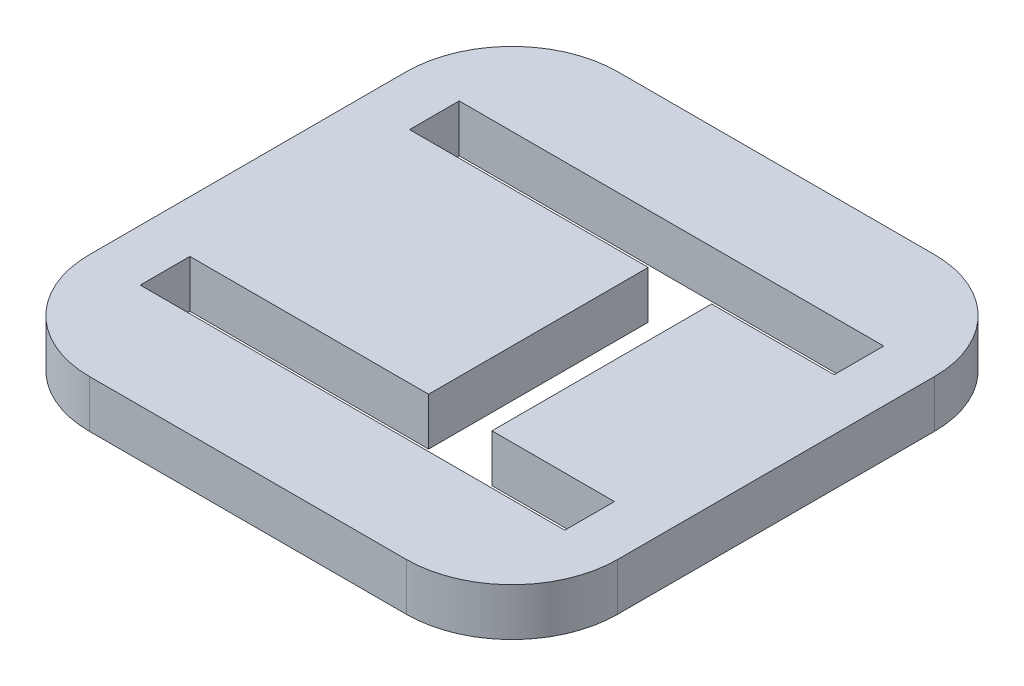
SolidWorks part; units mm, degrees
ref_plane "Plan de face" through (0, 0, 0) normal (0, 0, 1) x (1, 0, 0)
ref_plane "Plan de dessus" through (0, 0, 0) normal (0, 1, 0) x (1, 0, 0)
ref_plane "Plan de droite" through (0, 0, 0) normal (1, 0, 0) x (0, 0, -1)
sketch "Esquisse1" plane through (0, 0, 0) normal (0, 1, 0) x (1, 0, 0)
  line L0 (-85, 0) -> (15, 0) construction
  line L1 (-65, -50) -> (-5, -50)
  line L2 (-85, -30) -> (-85, 30)
  line L3 (-65, 50) -> (-5, 50)
  line L4 (15, -30) -> (15, 30)
  line L5 (5, 30) -> (5, 21) construction
  line L6 (-75, -21) -> (-75, -30) construction
  line L7 (-75.2, -30.2) -> (5.2, -30.2)
  line L8 (-75.2, -30.2) -> (-75.2, -20.8)
  line L9 (-75.2, -20.8) -> (-30, -20.8)
  line L10 (5.2, -30.2) -> (5.2, -20.8)
  line L11 (5.2, 20.8) -> (-18, 20.8)
  line L12 (5.2, 20.8) -> (5.2, 30.2)
  line L13 (5.2, 30.2) -> (-75.2, 30.2)
  line L14 (-75.2, 20.8) -> (-75.2, 30.2)
  line L15 (-75, -30) -> (5, -30) construction
  line L16 (5, -21) -> (5, -30) construction
  line L17 (5, 30) -> (5, 21) construction
  line L18 (-75, 30) -> (5, 30) construction
  line L19 (-75, 21) -> (5, 21) construction
  line L20 (-75, 30) -> (-75, 21) construction
  line L21 (-18, -20.8) -> (5.2, -20.8)
  line L22 (-30, 20.8) -> (-75.2, 20.8)
  line L23 (-30, -20.8) -> (-30, 20.8)
  line L24 (-30, 30) -> (-30, 17) construction
  line L25 (-18, -20.8) -> (-18, 20.8)
  arc A0 (-5, 50) -> (15, 30) centre (-5, 30) cw
  arc A1 (-85, 30) -> (-65, 50) centre (-65, 30) cw
  arc A2 (-65, -50) -> (-85, -30) centre (-65, -30) cw
  arc A3 (-5, -50) -> (15, -30) centre (-5, -30) ccw
  point P11 (15, 50)
  point P14 (-85, 50)
  point P19 (15, -50)
  dimension "D4" = 20
  dimension "D1" = 100
  dimension "D2" = 100
  dimension "D3" = 10
  dimension "D5" = 9.4
  dimension "D6" = 0.2
  dimension "D7" = 0.2
  dimension "D8" = 0.2
  dimension "D9" = 0.2
  dimension "D10" = 0.2
  dimension "D11" = 0.2
  dimension "D12" = 0.2
  dimension "D13" = 12
extrude "Boss.-Extru.1" add sketch "Esquisse1" against normal blind 9
